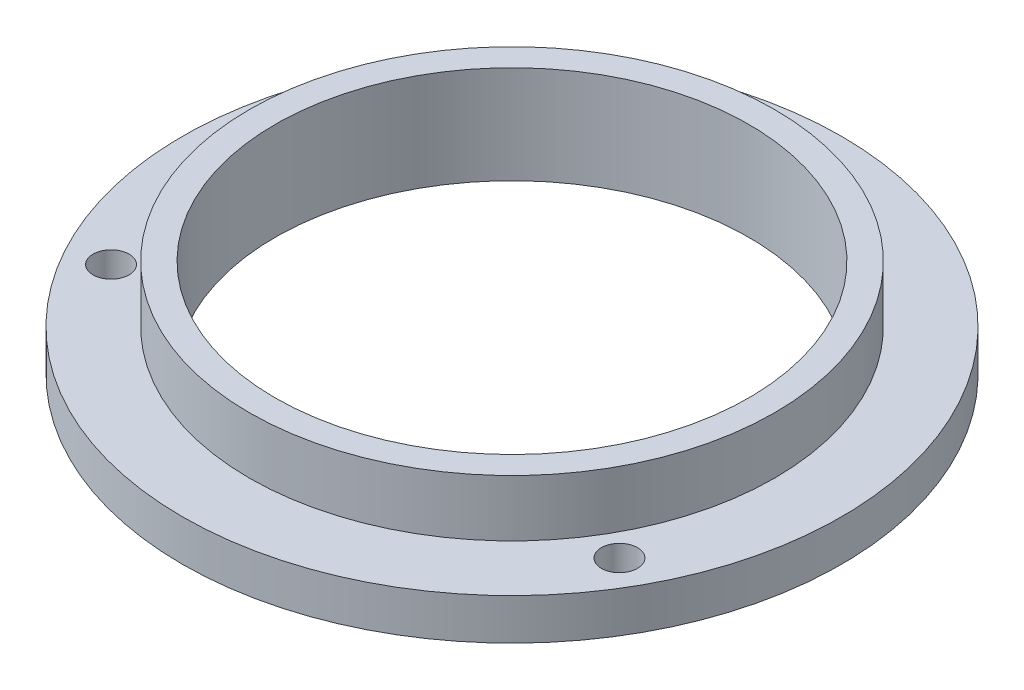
SolidWorks part; units mm, degrees
ref_plane "Piano frontale" through (0, 0, 0) normal (0, 0, 1) x (1, 0, 0)
ref_plane "Piano superiore" through (0, 0, 0) normal (0, 1, 0) x (1, 0, 0)
ref_plane "Piano destro" through (0, 0, 0) normal (1, 0, 0) x (0, 0, -1)
sketch "Schizzo1" plane through (0, 0, 0) normal (0, 0, 1) x (1, 0, 0)
  line L0 (0, 65.1723) -> (0, -77.4607) construction
  line L1 (23, -4) -> (32, -4)
  line L2 (32, -4) -> (32, 0)
  line L3 (32, 0) -> (25.5, 0)
  line L4 (25.5, 0) -> (25.5, 5.5)
  line L5 (25.5, 5.5) -> (23, 5.5)
  line L6 (23, 5.5) -> (23, -4)
  dimension "D1" = 23
  dimension "D2" = 32
  dimension "D3" = 2.5
  dimension "D4" = 4
  dimension "D5" = 9.5
  dimension "D6" = 6.5
revolve "Rivoluzione1" add sketch "Schizzo1" angle 360 about L0
sketch "Schizzo2" plane through (0, 0, 0) normal (0, 1, 0) x (1, 0, 0)
  circle A0 centre (0, 28.5) radius 1.75
  circle A1 centre (24.6817, -14.25) radius 1.75
  circle A2 centre (-24.6817, -14.25) radius 1.75
  point P9 (0, 0)
  dimension "D1" = 3
  dimension "D3" = 3.5
  dimension "D2" = 28.5
extrude "Taglio-Estrusione1" cut sketch "Schizzo2" against normal through all contours A0
